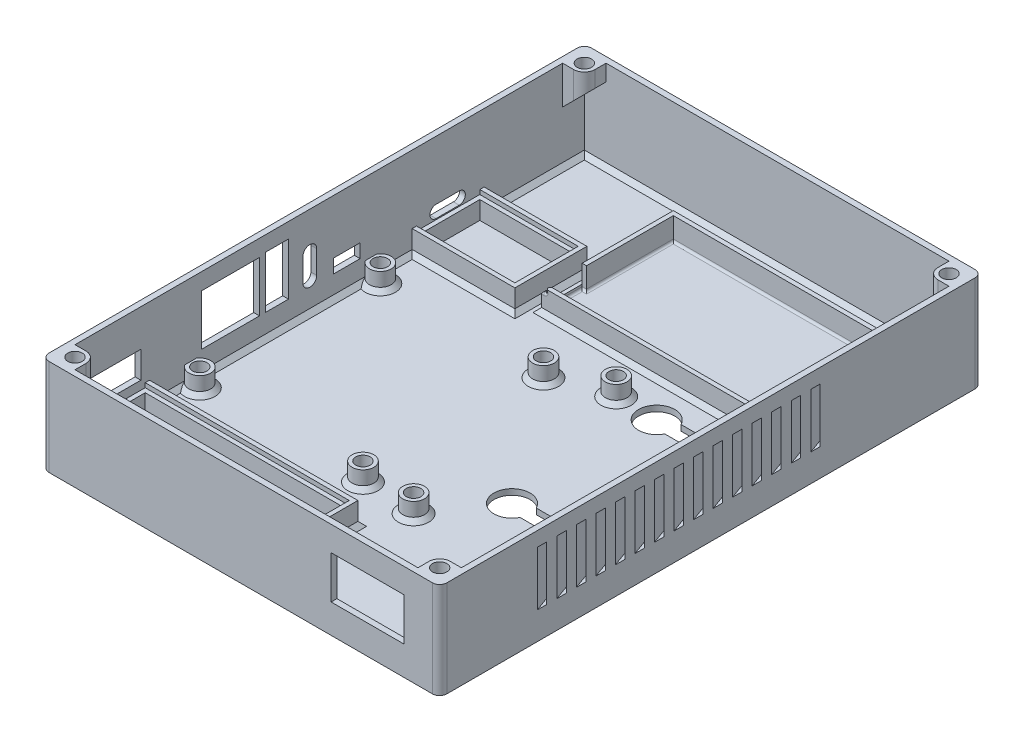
SolidWorks part; units mm, degrees
ref_plane "Front Plane" through (0, 0, 0) normal (0, 0, 1) x (1, 0, 0)
ref_plane "Top Plane" through (0, 0, 0) normal (0, 1, 0) x (1, 0, 0)
ref_plane "Right Plane" through (0, 0, 0) normal (1, 0, 0) x (0, 0, -1)
sketch "Sketch1" plane through (0, 0, 0) normal (0, 1, 0) x (1, 0, 0)
  line L1 (0, 0) -> (110, 0)
  line L4 (110, 0) -> (110, 150)
  line L5 (0, 0) -> (0, 150)
  line L6 (0, 150) -> (110, 150)
  dimension "D1" = 110
  dimension "D4" = 150
extrude "Boss-Extrude1" add sketch "Sketch1" along normal blind 1.6
ref_plane "Plane1" through (110, 1.6, -150) normal (-1, 0, 0) x (0, 0, 1)
sketch "Sketch3" plane through (0, 1.6, 0) normal (0, 1, 0) x (1, 0, 0)
  line L6 (108.4, 148.4) -> (1.6, 148.4)
  line L11 (1.6, 148.4) -> (1.6, 1.6)
  line L18 (1.6, 1.6) -> (108.4, 1.6)
  line L19 (108.4, 1.6) -> (108.4, 148.4)
  line L20 (0, 150) -> (0, 0)
  line L21 (0, 0) -> (110, 0)
  line L22 (110, 0) -> (110, 150)
  line L23 (110, 150) -> (0, 150)
  line L24 (0, 150) -> (0, 0)
  line L25 (0, 0) -> (110, 0)
  line L26 (110, 0) -> (110, 150)
  line L27 (110, 150) -> (0, 150)
  dimension "D1" = 0
  dimension "D2" = 1.6
extrude "Boss-Extrude2" add sketch "Sketch3" along normal blind 25
sketch "Sketch4" plane through (0, 1.6, 0) normal (0, 1, 0) x (1, 0, 0)
  line L1 (59.2, 28.2) -> (1.6, 28.2)
  line L2 (59.2, 28.2) -> (59.2, 8.8)
  line L3 (59.2, 8.8) -> (1.6, 8.8)
  line L4 (1.6, 28.2) -> (1.6, 8.8)
  line L5 (0, 0) -> (110, 0) construction
  line L6 (33.4, 104.8) -> (102.8, 104.8)
  line L7 (33.4, 104.8) -> (33.4, 141.2)
  line L8 (33.4, 141.2) -> (102.8, 141.2)
  line L9 (102.8, 104.8) -> (102.8, 141.2)
  line L10 (30, 100.8) -> (1.6, 100.8)
  line L11 (30, 100.8) -> (30, 120.7)
  line L12 (30, 120.7) -> (1.6, 120.7)
  line L13 (1.6, 100.8) -> (1.6, 120.7)
  line L14 (110, 150) -> (0, 150) construction
  line L15 (110, 0) -> (110, 150) construction
  line L16 (1.6, 148.4) -> (1.6, 1.6) construction
  line L17 (4.15, 89.45) -> (49.25, 89.45) construction
  line L18 (49.25, 89.45) -> (49.25, 39.55) construction
  line L19 (49.25, 39.55) -> (4.15, 39.55) construction
  line L20 (4.15, 39.55) -> (4.15, 89.45) construction
  line L21 (63.8, 95) -> (99.8, 95) construction
  line L22 (99.8, 95) -> (99.8, 39) construction
  line L23 (99.8, 39) -> (63.8, 39) construction
  line L24 (63.8, 39) -> (63.8, 95) construction
  line L25 (1.6, 148.4) -> (1.6, 1.6) construction
  line L26 (0, 150) -> (0, 0) construction
  circle A0 centre (4.15, 89.45) radius 3
  circle A1 centre (49.25, 89.45) radius 3
  circle A2 centre (49.25, 39.55) radius 3
  circle A3 centre (4.15, 39.55) radius 3
  circle A4 centre (63.8, 39) radius 3
  circle A5 centre (99.8, 39) radius 3
  circle A6 centre (99.8, 95) radius 3
  circle A7 centre (63.8, 95) radius 3
  dimension "D19" = 6
  dimension "D20" = 6
  dimension "D1" = 8.8
  dimension "D2" = 8.8
  dimension "D3" = 36.4
  dimension "D4" = 7.2
  dimension "D5" = 69.4
  dimension "D6" = 29.3
  dimension "D7" = 19.9
  dimension "D8" = 28.4
  dimension "D9" = 57.6
  dimension "D10" = 19.4
  dimension "D11" = 10.2
  dimension "D12" = 36
  dimension "D13" = 56
  dimension "D14" = 39
  dimension "D15" = 39.55
  dimension "D16" = 49.9
  dimension "D17" = 45.1
  dimension "D18" = 4.15
extrude "Boss-Extrude3" add sketch "Sketch4" along normal blind 5 contours L3 L2 L1 M4 | L11 L12 L10 M4 | A0 M4 | A3 M4 | L8 L9 L6 L7 | A1 | A7 | A6 | A5 | A4 | A2
chamfer "Chamfer1" distance 1.2 angle 45 26 edges at (30.4, 1.6, -28.2) (1.6, 1.6, -33.0848) (7.15, 1.6, -39.55) (1.6, 1.6, -64.5) (7.15, 1.6, -89.45) (1.6, 1.6, -95.9152) (15.8, 1.6, -100.8) (30, 1.6, -110.75) (15.8, 1.6, -120.7) (1.6, 1.6, -134.55) (55, 1.6, -148.4) (108.4, 1.6, -75) (55, 1.6, -1.6) (1.6, 1.6, -5.2) (30.4, 1.6, -8.8) (59.2, 1.6, -18.5) (102.8, 1.6, -123) (68.1, 1.6, -141.2) (33.4, 1.6, -123) (68.1, 1.6, -104.8) (99.8, 1.6, -42) (99.8, 1.6, -98) (63.8, 1.6, -98) (49.25, 1.6, -92.45) (63.8, 1.6, -42) (49.25, 1.6, -42.55)
sketch "Sketch5" plane through (0, 0, 0) normal (-1, 0, 0) x (0, 0, 1)
  line L0 (0, 26.6) -> (0, 0) construction
  line L1 (-25.8, 9) -> (-11.3, 9)
  line L2 (-25.8, 9) -> (-25.8, 16.4)
  line L3 (-25.8, 16.4) -> (-11.3, 16.4)
  line L4 (-11.3, 9) -> (-11.3, 16.4)
  line L5 (-150, 0) -> (0, 0) construction
  line L6 (-113.8, 8.6) -> (-107.4, 8.6) construction
  line L7 (-113.8, 10.3) -> (-107.4, 10.3)
  line L8 (-113.8, 6.9) -> (-107.4, 6.9)
  line L9 (-150, 26.6) -> (-150, 0) construction
  arc A0 (-113.8, 10.3) -> (-113.8, 6.9) centre (-113.8, 8.6) ccw
  arc A1 (-107.4, 6.9) -> (-107.4, 10.3) centre (-107.4, 8.6) ccw
  point P10 (-110.6, 8.6)
  dimension "D1" = 11.3
  dimension "D2" = 14.5
  dimension "D3" = 9
  dimension "D4" = 7.4
  dimension "D5" = 6.4
  dimension "D6" = 3.4
  dimension "D7" = 39.4
  dimension "D8" = 8.6
extrude "Cut-Extrude1" cut sketch "Sketch5" against normal blind 10
sketch "Sketch6" plane through (1.6, 0, 0) normal (1, 0, 0) x (0, 0, -1)
  line L0 (0, 26.6) -> (0, 0) construction
  line L1 (42.6, 8) -> (58.6, 8)
  line L2 (58.6, 8) -> (58.6, 22)
  line L3 (58.6, 22) -> (42.6, 22)
  line L4 (42.6, 22) -> (42.6, 8)
  line L5 (72.5, 16.2) -> (72.5, 9.8) construction
  line L6 (60.2, 8) -> (66.6, 8)
  line L7 (60.2, 8) -> (60.2, 22.4)
  line L8 (60.2, 22.4) -> (66.6, 22.4)
  line L9 (66.6, 8) -> (66.6, 22.4)
  line L10 (74.4, 16.2) -> (74.4, 9.8)
  line L11 (70.6, 16.2) -> (70.6, 9.8)
  line L12 (79, 7.8) -> (86.4, 7.8)
  line L13 (79, 7.8) -> (79, 11.6)
  line L14 (79, 11.6) -> (86.4, 11.6)
  line L15 (86.4, 7.8) -> (86.4, 11.6)
  line L16 (150, 0) -> (0, 0) construction
  arc A0 (74.4, 16.2) -> (70.6, 16.2) centre (72.5, 16.2) ccw
  arc A1 (70.6, 9.8) -> (74.4, 9.8) centre (72.5, 9.8) ccw
  point P12 (72.5, 13)
  dimension "D1" = 16
  dimension "D2" = 14
  dimension "D3" = 1.6
  dimension "D4" = 6.4
  dimension "D5" = 14.4
  dimension "D6" = 3.8
  dimension "D7" = 6.4
  dimension "D8" = 5.9
  dimension "D9" = 5
  dimension "D10" = 4.6
  dimension "D11" = 7.4
  dimension "D12" = 0.2
  dimension "D13" = 3.8
  dimension "D14" = 42.6
  dimension "D15" = 8
extrude "Cut-Extrude2" cut sketch "Sketch6" against normal blind 10
sketch "Sketch7" plane through (0, 6.6, 0) normal (0, 1, 0) x (1, 0, 0)
  line L0 (33.4, 123) -> (102.8, 123) construction
  line L1 (33.4, 104.8) -> (33.4, 141.2) construction
  line L2 (102.8, 104.8) -> (102.8, 141.2) construction
  line L3 (102.8, 123) -> (68.1, 141.2) construction
  line L4 (102.8, 141.2) -> (33.4, 141.2) construction
  line L5 (68.1, 141.2) -> (68.1, 104.8) construction
  line L6 (33.4, 104.8) -> (102.8, 104.8) construction
  line L7 (30, 110.75) -> (1.6, 110.75) construction
  line L8 (30, 100.8) -> (30, 120.7) construction
  line L9 (1.6, 120.7) -> (1.6, 100.8) construction
  line L10 (1.6, 110.75) -> (15.8, 120.7) construction
  line L11 (30, 120.7) -> (1.6, 120.7) construction
  line L12 (15.8, 120.7) -> (15.8, 100.8) construction
  line L13 (30, 100.8) -> (1.6, 100.8) construction
  line L14 (59.2, 18.5) -> (1.6, 18.5) construction
  line L15 (59.2, 28.2) -> (59.2, 8.8) construction
  line L16 (1.6, 28.2) -> (1.6, 8.8) construction
  line L17 (1.6, 18.5) -> (30.4, 28.2) construction
  line L18 (59.2, 28.2) -> (1.6, 28.2) construction
  line L19 (30.4, 28.2) -> (30.4, 8.8) construction
  line L20 (59.2, 8.8) -> (1.6, 8.8) construction
  line L21 (101.6, 140) -> (34.6, 140)
  line L22 (34.6, 140) -> (34.6, 116)
  line L23 (34.6, 106) -> (101.6, 106)
  line L24 (101.6, 106) -> (101.6, 140)
  line L25 (33.4, 141.2) -> (33.4, 104.8)
  line L26 (33.4, 104.8) -> (102.8, 104.8)
  line L27 (102.8, 104.8) -> (102.8, 141.2)
  line L28 (102.8, 141.2) -> (33.4, 141.2)
  line L29 (33.4, 141.2) -> (33.4, 116)
  line L30 (34.6, 104.8) -> (102.8, 104.8)
  line L31 (102.8, 104.8) -> (102.8, 141.2)
  line L32 (102.8, 141.2) -> (33.4, 141.2)
  line L33 (30, 100.8) -> (30, 120.7)
  line L34 (30, 120.7) -> (1.6, 120.7)
  line L35 (1.6, 120.7) -> (1.6, 100.8)
  line L36 (1.6, 100.8) -> (30, 100.8)
  line L37 (30, 100.8) -> (30, 120.7)
  line L38 (30, 120.7) -> (1.6, 120.7)
  line L39 (1.6, 120.7) -> (1.6, 119.5)
  line L40 (1.6, 100.8) -> (30, 100.8)
  line L41 (1.6, 8.8) -> (59.2, 8.8)
  line L42 (59.2, 8.8) -> (59.2, 28.2)
  line L43 (59.2, 28.2) -> (1.6, 28.2)
  line L44 (1.6, 28.2) -> (1.6, 8.8)
  line L45 (1.6, 8.8) -> (59.2, 8.8)
  line L46 (59.2, 8.8) -> (59.2, 28.2)
  line L47 (59.2, 28.2) -> (1.6, 28.2)
  line L48 (1.6, 28.2) -> (1.6, 27)
  line L49 (1.6, 102) -> (28.8, 102)
  line L50 (28.8, 102) -> (28.8, 119.5)
  line L51 (28.8, 119.5) -> (1.6, 119.5)
  line L52 (1.6, 10) -> (58, 10)
  line L53 (58, 10) -> (58, 27)
  line L54 (58, 27) -> (1.6, 27)
  line L55 (1.6, 102) -> (1.6, 100.8)
  line L56 (1.6, 10) -> (1.6, 8.8)
  line L57 (33.4, 104.8) -> (102.8, 104.8) construction
  line L58 (34.6, 116) -> (33.4, 116)
  line L59 (34.6, 104.8) -> (34.6, 106)
  line L60 (34.6, 140) -> (34.6, 106) construction
  line L61 (33.4, 141.2) -> (33.4, 104.8) construction
  dimension "D7" = 10
  dimension "D1" = 0
  dimension "D2" = 0
  dimension "D3" = 0
  dimension "D4" = 1.2
  dimension "D5" = 1.2
  dimension "D6" = 1.2
extrude "Boss-Extrude4" add sketch "Sketch7" along normal blind 1.2
sketch "Sketch8" plane through (0, 6.6, 0) normal (0, 1, 0) x (1, 0, 0)
  line L4 (27.6, 118.3) -> (2.8, 118.3)
  line L5 (2.8, 118.3) -> (2.8, 103.2)
  line L6 (2.8, 103.2) -> (27.6, 103.2)
  line L7 (27.6, 103.2) -> (27.6, 118.3)
  line L8 (28.8, 102) -> (28.8, 119.5)
  line L11 (34.6, 140) -> (101.6, 140)
  line L15 (34.6, 140) -> (101.6, 140) construction
  line L25 (28.8, 119.5) -> (1.6, 119.5)
  line L26 (1.6, 119.5) -> (1.6, 102)
  line L27 (1.6, 102) -> (28.8, 102)
  line L28 (28.8, 102) -> (28.8, 119.5) construction
  line L29 (28.8, 119.5) -> (1.6, 119.5) construction
  line L30 (1.6, 119.5) -> (1.6, 102) construction
  line L31 (1.6, 102) -> (28.8, 102) construction
  line L32 (56.8, 25.8) -> (2.8, 25.8)
  line L33 (2.8, 25.8) -> (2.8, 11.2)
  line L34 (2.8, 11.2) -> (56.8, 11.2)
  line L35 (56.8, 11.2) -> (56.8, 25.8)
  line L36 (58, 10) -> (58, 27)
  line L37 (58, 27) -> (1.6, 27)
  line L38 (1.6, 27) -> (1.6, 10)
  line L39 (1.6, 10) -> (58, 10)
  line L40 (58, 10) -> (58, 27) construction
  line L41 (58, 27) -> (1.6, 27) construction
  line L42 (1.6, 27) -> (1.6, 10) construction
  line L43 (1.6, 10) -> (58, 10) construction
  line L50 (34.6, 116) -> (34.6, 140) construction
  line L52 (101.6, 140) -> (101.6, 106)
  line L53 (101.6, 106) -> (33.4, 106)
  line L54 (33.4, 104.8) -> (33.4, 116) construction
  line L55 (33.4, 106) -> (33.4, 116)
  line L56 (33.4, 116) -> (34.6, 116)
  line L57 (34.6, 116) -> (34.6, 140)
  dimension "D3" = 0
  dimension "D4" = 1.2
  dimension "D5" = 0
  dimension "D6" = 1.2
extrude "Cut-Extrude3" cut sketch "Sketch8" against normal up to surface (5 mm away)
sketch "Sketch9" plane through (0, 1.6, 0) normal (0, 1, 0) x (1, 0, 0)
  line L0 (35.8, 138.8) -> (100.4, 107.2) construction
  line L1 (100.4, 138.8) -> (35.8, 108.2) construction
  line L2 (36.0249, 107.2) -> (68.1, 122.3935)
  line L5 (35.8, 109.3065) -> (65.764, 123.5)
  line L6 (37.8988, 107.2) -> (98.3012, 138.8) construction
  line L7 (100.4, 137.7631) -> (35.8, 108.2369) construction
  line L8 (35.8, 138.1573) -> (65.764, 123.5)
  line L11 (38.136, 138.8) -> (67.9169, 124.2322)
  line L12 (35.8, 136.7631) -> (100.4, 109.2369) construction
  line L13 (98.3012, 107.2) -> (37.8988, 138.8) construction
  line L15 (100.4, 138.8) -> (35.8, 138.8) construction
  line L16 (100.4, 138.8) -> (98.064, 138.8)
  line L17 (38.136, 138.8) -> (35.8, 138.8)
  line L18 (38.136, 138.8) -> (35.8, 138.8)
  line L19 (100.4, 107.2) -> (100.4, 138.8)
  line L20 (100.4, 138.8) -> (35.8, 138.8)
  line L21 (35.8, 138.8) -> (35.8, 107.2)
  line L22 (35.8, 107.2) -> (100.4, 107.2)
  line L23 (100.4, 107.2) -> (100.4, 109.3065)
  line L24 (100.4, 138.8) -> (98.064, 138.8)
  line L25 (35.8, 138.8) -> (35.8, 138.1573)
  line L26 (35.8, 107.2) -> (36.0249, 107.2)
  line L27 (100.4, 137.6935) -> (100.4, 138.8)
  line L28 (98.064, 107.2) -> (100.4, 107.2)
  line L29 (35.8, 109.3065) -> (35.8, 107.2)
  line L32 (67.9169, 124.2322) -> (98.064, 138.8)
  line L34 (70.436, 123.5) -> (100.4, 109.3065)
  line L35 (70.436, 123.5) -> (100.4, 137.6935)
  line L37 (68.1, 122.3935) -> (98.064, 107.2)
  point P9 (68.1, 123)
  point P10 (68.1, 123)
  dimension "D2" = 0
extrude "Boss-Extrude5" [suppressed] add sketch "Sketch9" along normal up to surface (5 mm away)
fillet "Fillet3" radius 0.6 11 edges at (34.6, 7.2, -104.8) (34, 6.6, -104.8) (33.4, 6.6, -105.4) (34, 6.6, -106) (34.6, 7.2, -106) (68.1, 1.6, -140) (101.6, 1.6, -123) (67.5, 1.6, -106) (33.4, 1.6, -111) (34, 1.6, -116) (34.6, 1.6, -128)
sketch "Sketch10" plane through (0, 0, 0) normal (0, 0, 1) x (1, 0, 0)
  line L0 (0, 0) -> (110, 0) construction
  line L1 (100.2, 19.8) -> (80, 19.8)
  line L2 (100.2, 19.8) -> (100.2, 8)
  line L3 (100.2, 8) -> (80, 8)
  line L4 (80, 19.8) -> (80, 8)
  line L5 (110, 56.6) -> (110, -53.4) construction
  dimension "D1" = 20.2
  dimension "D2" = 11.8
  dimension "D3" = 8
  dimension "D4" = 9.8
extrude "Cut-Extrude4" cut sketch "Sketch10" against normal blind 6
ref_plane "Plane2" through (0, 7.6, 0) normal (0, 1, 0) x (1, 0, 0)
sketch "Sketch11" plane through (0, 7.6, 0) normal (0, 1, 0) x (1, 0, 0)
  line L0 (108.4, 31.396) -> (110, 27)
  line L1 (108.4, 1.6) -> (108.4, 148.4) construction
  line L2 (110, 0) -> (110, 150) construction
  line L3 (110, 27) -> (110, 29.6)
  line L4 (110, 29.6) -> (108.4, 33.996)
  line L5 (108.4, 33.996) -> (108.4, 31.396)
  line L6 (0, 0) -> (110, 0) construction
  dimension "D1" = 20
  dimension "D2" = 2.6
  dimension "D3" = 27
extrude "Cut-Extrude5" cut sketch "Sketch11" along normal blind 15
pattern_linear "LPattern1" count 15 spacing 5.4 along (0.9397, 0, -0.342) of "Cut-Extrude5"
sketch "Sketch12" plane through (0, 6.6, 0) normal (0, 1, 0) x (1, 0, 0)
  circle A0 centre (49.25, 89.45) radius 2
  circle A1 centre (4.15, 89.45) radius 2
  circle A2 centre (4.15, 39.55) radius 2
  circle A3 centre (49.25, 39.55) radius 2
  circle A4 centre (63.8, 39) radius 2
  circle A5 centre (99.8, 39) radius 2
  circle A6 centre (99.8, 95) radius 2
  circle A7 centre (63.8, 95) radius 2
  dimension "D1" = 4
extrude "Cut-Extrude6" cut sketch "Sketch12" against normal blind 5
sketch "Sketch14" plane through (0, 0, -148.4) normal (0, 0, 1) x (1, 0, 0)
  line L0 (1.6, 26.6) -> (7.6, 26.6)
  line L1 (108.4, 26.6) -> (1.6, 26.6) construction
  line L2 (7.6, 26.6) -> (7.6, 22.1)
  line L3 (7.6, 22.1) -> (1.6, 16.1)
  line L4 (1.6, 26.6) -> (1.6, 2.8) construction
  line L5 (1.6, 16.1) -> (1.6, 26.6)
  dimension "D1" = 6
  dimension "D2" = 4.5
  dimension "D3" = 45
extrude "Boss-Extrude7" add sketch "Sketch14" along normal blind 6
ref_plane "Plane3" through (55, 0, 0) normal (1, 0, 0) x (0, 0, -1)
ref_plane "Plane4" through (0, 0, -75) normal (0, 0, -1) x (-1, 0, 0)
mirror "Mirror1" about plane through (0, 0, -75) normal (0, 0, -1) of "Boss-Extrude7"
mirror "Mirror2" about plane through (55, 0, 0) normal (1, 0, 0) of "Mirror1", "Boss-Extrude7"
fillet "Fillet2" radius 3 4 edges at (102.4, 24.35, -142.4) (102.4, 24.35, -7.6) (7.6, 24.35, -142.4) (7.6, 24.35, -7.6)
sketch "Sketch15" plane through (0, 26.6, 0) normal (0, 1, 0) x (1, 0, 0)
  circle A0 centre (4.6, 4.6) radius 2
  circle A1 centre (105.4, 4.6) radius 2
  circle A2 centre (105.4, 145.4) radius 2
  circle A3 centre (4.6, 145.4) radius 2
  dimension "D1" = 4
extrude "Cut-Extrude7" cut sketch "Sketch15" against normal blind 5
fillet "Fillet4" radius 2 4 edges at (0, 13.3, 0) (110, 13.3, 0) (110, 13.3, -150) (0, 13.3, -150)
sketch "Sketch16" plane through (0, 1.6, 0) normal (0, 1, 0) x (1, 0, 0)
  line L0 (108.4, 75) -> (1.6, 75) construction
  line L1 (108.4, 7.6) -> (108.4, 142.4) construction
  line L2 (1.6, 142.4) -> (1.6, 7.6) construction
  line L3 (65, 95) -> (85, 95) construction
  line L4 (65, 97.25) -> (85, 97.25)
  line L5 (65, 92.75) -> (85, 92.75)
  line L6 (65, 55) -> (85, 55) construction
  line L7 (65, 57.25) -> (85, 57.25)
  line L8 (65, 52.75) -> (85, 52.75)
  line L9 (110, 2) -> (110, 148) construction
  circle A0 centre (75, 95) radius 5
  circle A1 centre (75, 55) radius 5
  arc A2 (65, 97.25) -> (65, 92.75) centre (65, 95) ccw
  arc A3 (85, 92.75) -> (85, 97.25) centre (85, 95) ccw
  arc A4 (65, 57.25) -> (65, 52.75) centre (65, 55) ccw
  arc A5 (85, 52.75) -> (85, 57.25) centre (85, 55) ccw
  point P12 (75, 95)
  point P18 (75, 55)
  dimension "D1" = 10
  dimension "D5" = 35
  dimension "D2" = 40
  dimension "D3" = 4.5
  dimension "D4" = 20
extrude "Cut-Extrude8" cut sketch "Sketch16" against normal through all contours L8 A5 L7 A1 | L5 A3 L4 A0
